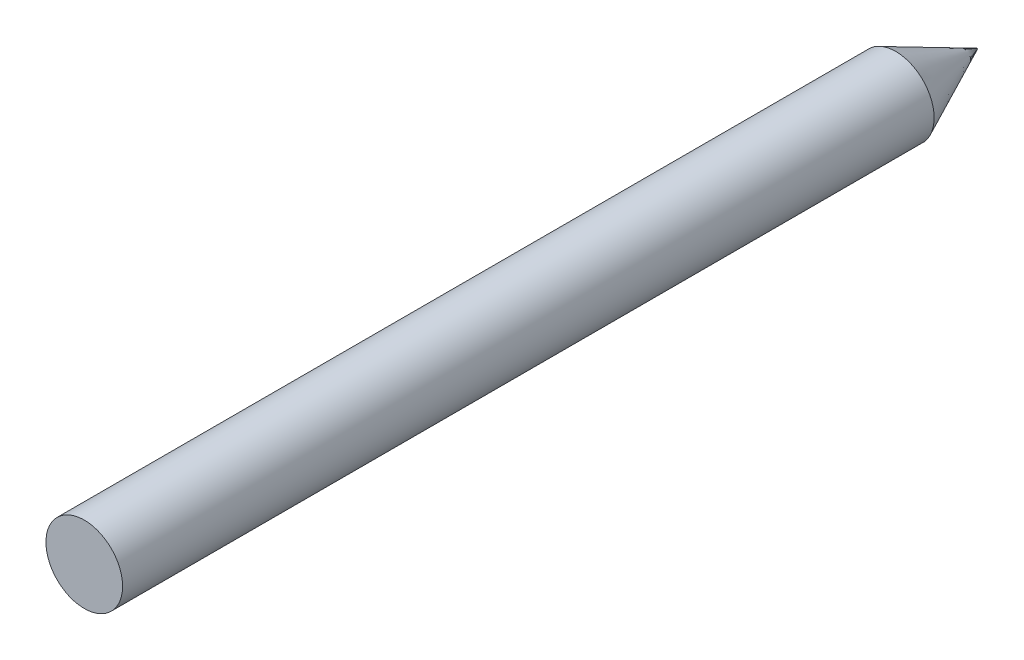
SolidWorks part; units mm, degrees
ref_plane "Plan de face" through (0, 0, 0) normal (0, 0, 1) x (1, 0, 0)
ref_plane "Plan de dessus" through (0, 0, 0) normal (0, 1, 0) x (1, 0, 0)
ref_plane "Plan de droite" through (0, 0, 0) normal (1, 0, 0) x (0, 0, -1)
sketch "Esquisse1" plane through (0, 0, 0) normal (0, 0, 1) x (1, 0, 0)
  circle A1 centre (0, 0) radius 4.25
extrude "Extrusion1" add sketch "Esquisse1" along normal blind 40 and the other way blind 50
sketch "Esquisse2" plane through (0, 0, -50) normal (0, 0, -1) x (-1, 0, 0)
  circle A1 centre (0, 0) radius 4.25
  circle A2 centre (0, 0) radius 4.25
  dimension "D1" = 0
extrude "Extrusion2" add sketch "Esquisse2" along normal blind 40 draft 25
